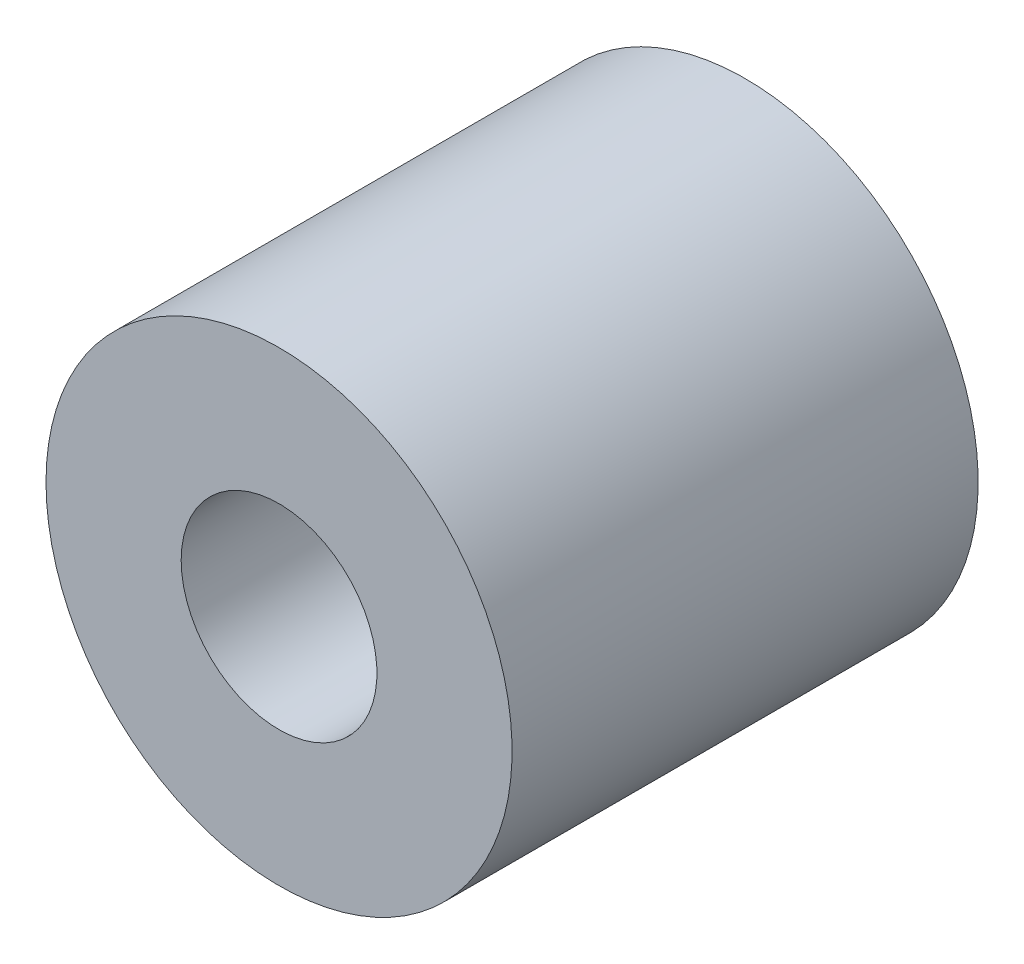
SolidWorks part; units mm, degrees
ref_plane "Front Plane" through (0, 0, 0) normal (0, 0, 1) x (1, 0, 0)
ref_plane "Top Plane" through (0, 0, 0) normal (0, 1, 0) x (1, 0, 0)
ref_plane "Right Plane" through (0, 0, 0) normal (1, 0, 0) x (0, 0, -1)
sketch "Sketch1" plane through (0, 0, 0) normal (0, 0, 1) x (1, 0, 0)
  circle A0 centre (0, 0) radius 4.0005
  circle A1 centre (0, 0) radius 9.525
  dimension "D1" = 8.001
  dimension "D2" = 19.05
extrude "Boss-Extrude1" add sketch "Sketch1" along normal blind 19.05
